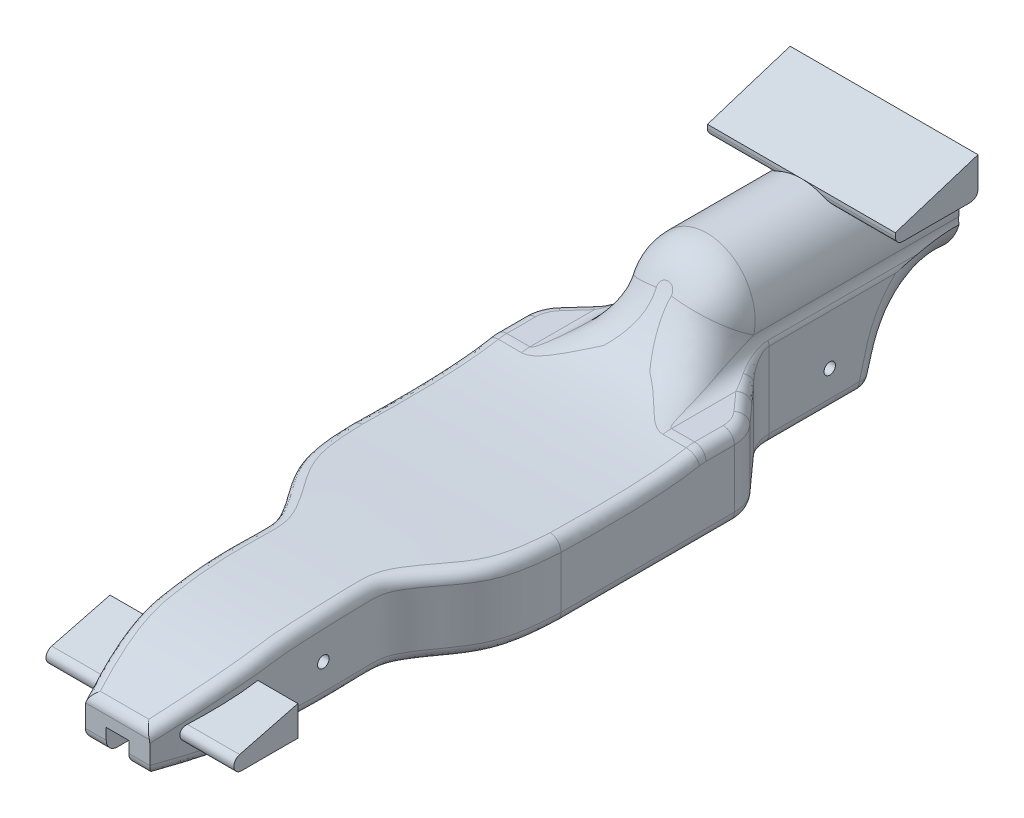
SolidWorks part; units mm, degrees
ref_plane "Front Plane" through (0, 0, 0) normal (0, 0, 1) x (1, 0, 0)
ref_plane "Top Plane" through (0, 0, 0) normal (0, 1, 0) x (1, 0, 0)
ref_plane "Right Plane" through (0, 0, 0) normal (1, 0, 0) x (0, 0, -1)
sketch "Sketch1" plane through (0, 0, 0) normal (0, 0, 1) x (1, 0, 0)
  line L1 (-32.5, 0) -> (32.5, 0)
  line L2 (-32.5, 0) -> (-32.5, 50)
  line L3 (-32.5, 50) -> (32.5, 50)
  line L4 (32.5, 0) -> (32.5, 50)
  dimension "D1" = 65
  dimension "D2" = 50
extrude "Balsa Block" add sketch "Sketch1" along normal blind 223
sketch "Sketch2" plane through (0, 0, 223) normal (0, 0, 1) x (1, 0, 0)
  line L0 (-32.5, 0) -> (32.5, 0) construction
  line L1 (-3, 0) -> (3, 0)
  line L2 (-3, 0) -> (-3, 6)
  line L3 (-3, 6) -> (3, 6)
  line L4 (3, 0) -> (3, 6)
  dimension "D1" = 6
  dimension "D2" = 6
extrude "Screw Eye Slot" cut sketch "Sketch2" against normal through all
sketch "Sketch3" plane through (0, 0, 0) normal (0, 0, -1) x (-1, 0, 0)
  line L0 (32.5, 0) -> (3, 0) construction
  circle A0 centre (0, 29) radius 9.55
  dimension "D1" = 19.1
  dimension "D2" = 29
extrude "CO2 Cartridge Hole" cut sketch "Sketch3" against normal blind 52
sketch "Sketch4" plane through (32.5, 0, 0) normal (1, 0, 0) x (0, 0, -1)
  line L0 (-223, 0) -> (0, 0) construction
  line L1 (0, 0) -> (0, 50) construction
  circle A0 centre (-170, 10) radius 1.525
  circle A1 centre (-35, 10) radius 1.525
  dimension "D4" = 3.05
  dimension "D1" = 10
  dimension "D2" = 135
  dimension "D3" = 35
extrude "Axle Hole Cut Out" cut sketch "Sketch4" against normal through all
sketch "Sketch5" plane through (0, 50, 0) normal (0, 1, 0) x (1, 0, 0)
  line L0 (32.5, 0) -> (-32.5, 0) construction
  line L1 (0, 0) -> (0, -229.7898) construction
  line L2 (-14.55, 0) -> (-14.55, -51.1732)
  line L3 (-17.1047, -57.8491) -> (-25.4453, -67.1509)
  line L4 (-28, -73.8268) -> (-28, -120)
  line L5 (-14.4879, 48.8908) -> (-14.4879, 49.7327) construction
  line L6 (28, -73.8268) -> (28, -120)
  line L7 (17.1047, -57.8491) -> (25.4453, -67.1509)
  line L8 (14.55, 0) -> (14.55, -51.1732)
  line L9 (-14.7766, 49.831) -> (-14.7766, 50.2789) construction
  line L10 (-9.55, 0) -> (-9.55, -52) construction
  line L11 (9.55, -52) -> (9.55, 0) construction
  arc A0 (-25.4453, -67.1509) -> (-28, -73.8268) centre (-18, -73.8268) ccw
  arc A1 (-14.55, -51.1732) -> (-17.1047, -57.8491) centre (-24.55, -51.1732) cw
  arc A2 (14.55, -51.1732) -> (17.1047, -57.8491) centre (24.55, -51.1732) ccw
  arc A3 (25.4453, -67.1509) -> (28, -73.8268) centre (18, -73.8268) cw
  spline S0 degree 3 poles (-28, -120) (-27.6859, -126.0056) (-27.1636, -135.9946) (-19.7034, -144.9636) (-13.3488, -154.8578) (-14.7766, -154.2092) (-14.7766, -173.3072) (-14.4879, -181.2754) (-14.4879, -195.7718) (-8.4397, -210.8954) (-2.3915, -226.019) knots 0 0 0 0 0.179945 0.299298 0.299298 0.625194 0.625194 0.690626 0.690626 1 1 1 1
  spline S1 degree 3 poles (28, -120) (27.6859, -126.0056) (27.1636, -135.9946) (19.7034, -144.9636) (13.3488, -154.8578) (14.7766, -154.2092) (14.7766, -173.3072) (14.4879, -181.2754) (14.4879, -195.7718) (8.4397, -210.8954) (2.3915, -226.019) knots 0 0 0 0 0.179945 0.299298 0.299298 0.625194 0.625194 0.690626 0.690626 1 1 1 1
  spline S2 degree 3 poles (-14.55, 0) (-14.55, -18.3333) (-14.55, -36.6667) (-14.55, -55) knots 0 0 0 0 1 1 1 1
  spline S3 degree 3 poles (14.55, 0) (14.55, -18.3333) (14.55, -36.6667) (14.55, -55) knots 0 0 0 0 1 1 1 1
  dimension "D2" = 5
  dimension "D1" = 5
sketch "Sketch6" plane through (0, 0, 0) normal (1, 0, 0) x (0, 0, -1)
  line L1 (-52, 19.45) -> (0, 19.45) construction
  line L3 (0, 26.4) -> (0, -26.4) construction
  line L10 (-210, 10.9116) -> (-210, 0)
  line L13 (-210, 0) -> (-22.7709, 0)
  spline S0 degree 3 poles (-210, 10.9116) (-202.7227, 13.8598) (-188.783, 19.5071) (-143.7313, 22.444) (-85.5632, 16.1988) (-63.4626, 33.1745) (-61.6089, 55.2214) (-24.8176, 48.2515) (0, 43.55) knots 0 0 0 0 0.060945 0.11674 0.333018 0.333018 0.550088 1 1 1 1
  spline S1 degree 3 poles (-22.7709, 0) (-21.942, 3.2613) (-20.3664, 9.4604) (-11.2641, 16.1435) (-4.1106, 15.068) (0, 14.45) knots 0 0 0 0 0.32075 0.609686 1 1 1 1
  dimension "D3" = 5
  dimension "D1" = 210
  dimension "D2" = 5
sketch "Sketch7" plane through (0, 0, 0) normal (0, 0, -1) x (-1, 0, 0)
  line L0 (18.8348, 21.5) -> (32.5, 21.5)
  line L2 (-18.8348, 21.5) -> (-32.5, 21.5)
  line L5 (0, 0) -> (0, 64.6236) construction
  arc A0 (13.8783, 27.1579) -> (-13.8783, 27.1579) centre (0, 29) ccw
  arc A1 (-13.8783, 27.1579) -> (-18.8348, 21.5) centre (-18.8348, 26.5) cw
  arc A2 (13.8783, 27.1579) -> (18.8348, 21.5) centre (18.8348, 26.5) ccw
  dimension "D1" = 14
  dimension "D3" = 5
  dimension "D2" = 21.5
  dimension "D4" = 65
sketch "Sketch8" plane through (0, 0, 0) normal (1, 0, 0) x (0, 0, -1)
  line L0 (-202.5076, 10) -> (-187, 14)
  line L1 (-187, 14) -> (-187, 6)
  line L2 (-187, 6) -> (-202, 6)
  line L3 (-210, 0) -> (-22.7709, 0) construction
  line L6 (-210, 10.9116) -> (-210, 0) construction
  arc A0 (-202.5076, 10) -> (-202, 6) centre (-202, 8.0322) ccw
  dimension "D1" = 15
  dimension "D2" = 6
  dimension "D3" = 8
  dimension "D4" = 10
  dimension "D5" = 8
extrude "Cut-Extrude1" cut sketch "Sketch5" against normal through all contours S0 L4 A0 L3 A1 L2 M33 M34 M35 | L6 S1 L8 A2 L7 A3 M35 M36 M33
extrude "Cut-Extrude2" cut sketch "Sketch6" against normal through all and the other way through all flip side to cut
extrude "Cut-Extrude3" cut sketch "Sketch7" against normal through all and the other way through all flip side to cut
extrude "Boss-Extrude1" add sketch "Sketch8" along normal mid plane 50
sketch "Sketch9" plane through (0, 0, 0) normal (1, 0, 0) x (0, 0, -1)
  line L0 (-28, 43) -> (-6, 50)
  line L1 (0, 43) -> (-59.8515, 43) construction
  line L2 (-6, 50) -> (-6, 42)
  line L3 (-8, 40) -> (-26, 40)
  line L4 (-28, 42) -> (-28, 43)
  line L5 (0, 27.1579) -> (0, 43) construction
  arc A0 (-6, 42) -> (-8, 40) centre (-8, 42) cw
  arc A1 (-26, 40) -> (-28, 42) centre (-26, 42) cw
  dimension "D1" = 2
  dimension "D2" = 3
  dimension "D3" = 10
  dimension "D4" = 22
  dimension "D5" = 6
extrude "Boss-Extrude2" add sketch "Sketch9" along normal mid plane 50
fillet "Fillet1" radius 3 31 edges at (14.55, 0, 36.9721) (15.2105, 0, 54.7472) (21.275, 0, 62.5) (27.3395, 0, 70.2528) (28, 0, 96.9134) (5.7908, 0, 210) (-5.7908, 0, 210) (-28, 0, 96.9134) (-27.3395, 0, 70.2528) (-21.275, 0, 62.5) (-15.2105, 0, 54.7472) (-14.55, 0, 36.9721) (-14.55, 23.9231, 25.5866) (-14.7762, 23.5797, 53.2883) (-17.9561, 21.5778, 58.7986) (-22.14, 21.5, 63.4647) (-27.3395, 21.5, 70.2528) (-28, 21.5, 78.2147) (-15.33, 20.6441, 152.4527) (0, 10.9116, 210) (14.55, 23.9231, 25.5866) (14.7762, 23.5797, 53.2883) (17.9561, 21.5778, 58.7986) (22.14, 21.5, 63.4647) (27.3395, 21.5, 70.2528) (28, 21.5, 78.2147) (15.33, 20.6441, 152.4527)
fillet "Fillet2" radius 12 7 edges at (-26.8663, 20.8488, 82.5337) (26.8663, 20.8488, 82.5337) (21.9174, 21.5, 82.6025) (17.1807, 21.7815, 81.3793) (-21.9174, 21.5, 82.6025) (-17.3362, 21.7299, 81.5913) (0.0541, 42.9999, 59.8516)
fillet "VarFillet1" radius 15 2 edges
